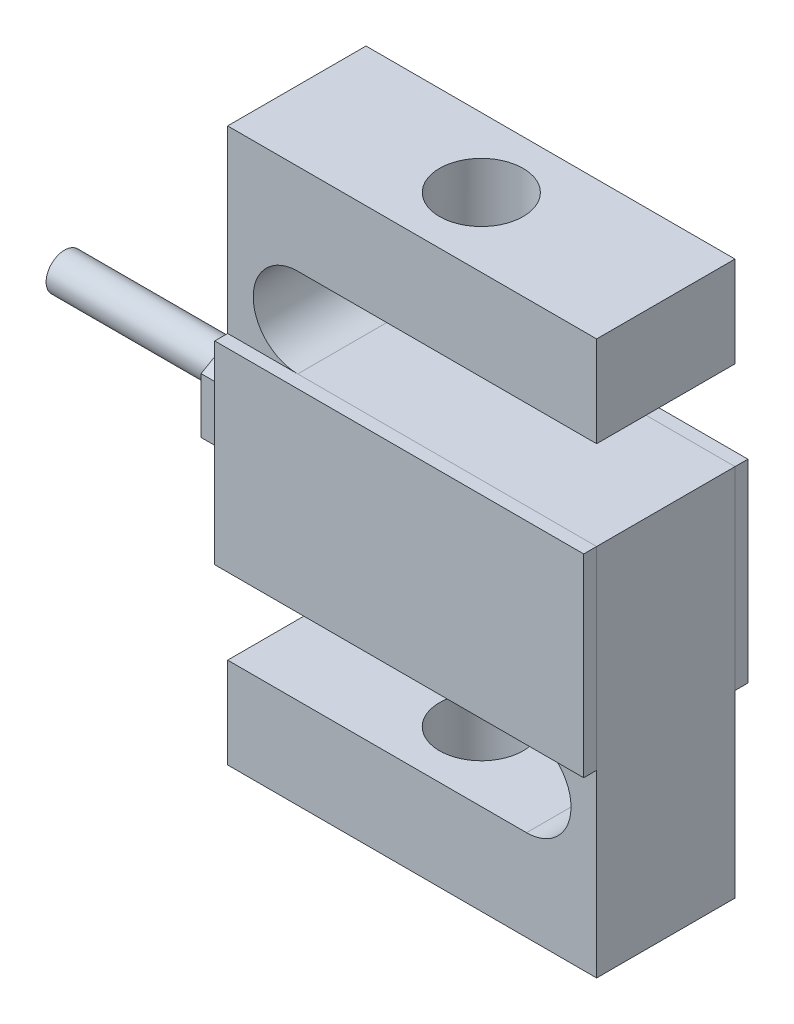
SolidWorks part; units mm, degrees
ref_plane "Front Plane" through (0, 0, 0) normal (0, 0, 1) x (1, 0, 0)
ref_plane "Top Plane" through (0, 0, 0) normal (0, 1, 0) x (1, 0, 0)
ref_plane "Right Plane" through (0, 0, 0) normal (1, 0, 0) x (0, 0, -1)
sketch "Sketch1" plane through (0, 0, 0) normal (0, 0, 1) x (1, 0, 0)
  line L0 (-25.4, -38.1) -> (25.4, -38.1)
  line L1 (25.4, -38.1) -> (25.4, 13.35)
  line L2 (25.4, 38.1) -> (-25.4, 38.1)
  line L3 (-25.4, 38.1) -> (-25.4, -13.35)
  line L4 (-25.4, -13.35) -> (15.748, -13.35)
  line L5 (-25.4, -25.6) -> (15.748, -25.6)
  line L6 (-69.5262, 0) -> (58.1333, 0) construction
  line L7 (15.748, -13.35) -> (15.748, -25.6) construction
  line L8 (-25.4, -25.6) -> (-25.4, -38.1)
  line L9 (-15.748, 25.6) -> (25.4, 25.6)
  line L10 (-15.748, 13.35) -> (25.4, 13.35)
  line L11 (25.4, 25.6) -> (25.4, 38.1)
  line L12 (-15.748, 25.6) -> (-15.748, 13.35) construction
  arc A0 (15.748, -25.6) -> (15.748, -13.35) centre (15.748, -19.475) ccw
  arc A1 (-15.748, 25.6) -> (-15.748, 13.35) centre (-15.748, 19.475) ccw
  dimension "D6" = 9.652
  dimension "D1" = 50.8
  dimension "D2" = 76.2
  dimension "D3" = 38.1
  dimension "D4" = 12.25
  dimension "D5" = 12.5
  dimension "D7" = 25.4
extrude "Extrude1" add sketch "Sketch1" along normal mid plane 19.05
sketch "Sketch2" plane through (-25.4, 0, 0) normal (-1, 0, 0) x (0, 0, 1)
  circle A0 centre (0, 0) radius 6.35
  dimension "D1" = 12.7
extrude "Extrude2" add sketch "Sketch2" along normal blind 1.5
sketch "Sketch3" plane through (-26.9, 0, 0) normal (-1, 0, 0) x (0, 0, 1)
  line L1 (0, 7.62) -> (-6.5991, 3.81)
  line L2 (-6.5991, 3.81) -> (-6.5991, -3.81)
  line L3 (-6.5991, -3.81) -> (0, -7.62)
  line L4 (0, -7.62) -> (6.5991, -3.81)
  line L5 (6.5991, -3.81) -> (6.5991, 3.81)
  line L6 (6.5991, 3.81) -> (0, 7.62)
  circle A0 centre (0, 0) radius 6.5991 construction
  dimension "D1" = 15.24
extrude "Extrude3" add sketch "Sketch3" along normal blind 5.08
sketch "Sketch4" plane through (-31.98, 0, 0) normal (-1, 0, 0) x (0, 0, 1)
  circle A0 centre (0, 0) radius 2.54
  dimension "D1" = 5.08
extrude "Extrude4" add sketch "Sketch4" along normal blind 25.4
hole_wizard "1/2-20 Tapped Hole1" positions "3DSketch2" profile "Sketch9" tap size "1/2-20" standard "Ansi Inch"
sketch3d "3DSketch2"
  point P0 (0, 38.1, 0)
sketch "Sketch9" plane through (0, 38.1, 0) normal (1, 0, 0) x (0, 0, 1)
  line L0 (0, 0) -> (0, 51.45)
  line L1 (0, 51.45) -> (5.7544, 51.45)
  line L2 (5.7544, 51.45) -> (5.7544, 0)
  line L5 (5.7544, 0) -> (0, 0)
  line L11 (0, -6.35) -> (0, 107.95) construction
  dimension "Thru Tap Drill Dia." = 11.5087
  dimension "Thru Tap Drill Depth" = 51.45
mirror "Mirror1" about plane through (0, 0, 0) normal (0, 1, 0) of "1/2-20 Tapped Hole1"
sketch "Sketch5" plane through (0, 0, 9.525) normal (0, 0, 1) x (1, 0, 0)
  line L0 (25.4, 13.35) -> (-15.748, 13.35) construction
  line L1 (25.4, 13.35) -> (-25.4, 13.35)
  line L2 (25.4, 13.35) -> (25.4, -13.335)
  line L3 (25.4, -13.335) -> (-25.4, -13.335)
  line L4 (-25.4, 13.35) -> (-25.4, -13.335)
  line L5 (-25.4, 38.1) -> (-25.4, -13.35) construction
extrude "Extrude5" add sketch "Sketch5" along normal blind 1.778 separate body
sketch "Sketch7" plane through (0, 0, -9.525) normal (0, 0, -1) x (-1, 0, 0)
  line L0 (25.4, -13.35) -> (-15.748, -13.35) construction
  line L1 (-25.4, 13.35) -> (25.4, 13.35)
  line L2 (-25.4, 13.35) -> (-25.4, -13.35)
  line L3 (-25.4, -13.35) -> (25.4, -13.35)
  line L4 (25.4, 13.35) -> (25.4, -13.35)
extrude "Extrude6" add sketch "Sketch7" along normal blind 1.778 separate body
